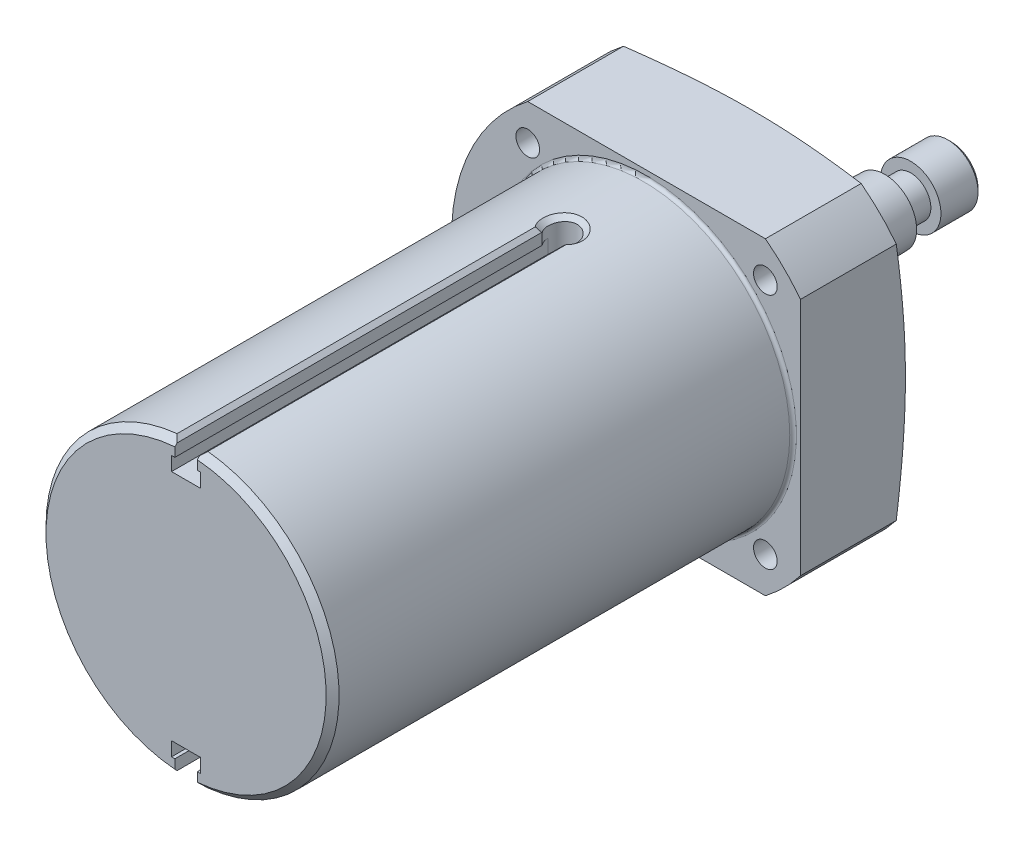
SolidWorks part; units mm, degrees
ref_plane "Front Plane" through (0, 0, 0) normal (0, 0, 1) x (1, 0, 0)
ref_plane "Top Plane" through (0, 0, 0) normal (0, 1, 0) x (1, 0, 0)
ref_plane "Right Plane" through (0, 0, 0) normal (1, 0, 0) x (0, 0, -1)
sketch "Sketch1" plane through (0, 0, 0) normal (0, 0, 1) x (1, 0, 0)
  line L0 (0, 0) -> (62.0084, 0) construction
  line L1 (-28.0574, 36.4998) -> (28.0574, 36.4998)
  line L2 (36.3474, 28.2545) -> (36.3474, -28.2545)
  line L3 (-28.0574, -36.4998) -> (28.0574, -36.4998)
  arc A0 (-28.0574, 36.4998) -> (-28.0574, -36.4998) centre (0, 0) ccw
  arc A1 (36.3474, 28.2545) -> (28.0574, 36.4998) centre (0, 0) ccw
  arc A2 (28.0574, -36.4998) -> (36.3474, -28.2545) centre (0, 0) ccw
  dimension "D1" = 92.075
  dimension "D2" = 72.9996
  dimension "D3" = 36.3474
extrude "Extrude1" add sketch "Sketch1" along normal blind 138.938
sketch "Sketch2" plane through (0, 0, 0) normal (0, 1, 0) x (1, 0, 0)
  line L0 (0, 0) -> (0, -96.9332) construction
  line L1 (-46.0375, -30.226) -> (-34.5948, -30.226)
  line L2 (-46.0375, 0) -> (-46.0375, -138.938) construction
  line L3 (-34.5948, -30.226) -> (-34.5948, -138.938)
  line L5 (-11.7475, 0) -> (-46.0375, -7.62)
  line L6 (28.0574, 0) -> (-28.0574, 0) construction
  line L7 (-34.5948, -138.938) -> (-46.0375, -138.938)
  line L8 (-46.0375, -138.938) -> (-46.0375, -30.226)
  line L9 (-46.0375, -7.62) -> (-46.0375, 0)
  line L10 (-28.0574, 0) -> (-46.0375, 0) construction
  line L11 (-46.0375, 0) -> (-11.7475, 0)
  dimension "D1" = 108.712
  dimension "D2" = 69.1896
  dimension "D5" = 23.495
  dimension "D6" = 7.62
revolve "Cut-Revolve1" cut sketch "Sketch2" angle 360 about L0
sketch "Sketch4" plane through (0, 0, 0) normal (0, 1, 0) x (1, 0, 0)
  line L0 (0, 0) -> (0, -99.9671) construction
  line L1 (7.9311, 0) -> (7.9311, 13.081)
  line L2 (11.7475, 0) -> (-11.7475, 0) construction
  line L3 (7.9311, 13.081) -> (7.5247, 26.0129)
  line L4 (7.5247, 26.0129) -> (0, 26.0129)
  line L5 (-28.0574, -30.226) -> (28.0574, -30.226) construction
  line L7 (0, 26.0129) -> (0, 0)
  line L8 (0, 0) -> (7.9311, 0)
  dimension "D1" = 1.8
  dimension "D2" = 43.307
  dimension "D4" = 15.8623
  dimension "D5" = 15.0495
  dimension "D6" = 12.9319
revolve "Revolve1" add sketch "Sketch4" angle 360 about L0
hole_wizard "Hole1" positions "Sketch6" profile "Sketch5" legacy
sketch "Sketch6" plane through (0, 0, -26.0129) normal (0, 0, -1) x (-1, 0, 0)
  circle A0 centre (0, 0) radius 7.5247 construction
  point P0 (0, 0)
sketch "Sketch5" plane through (0, 0, -26.0129) normal (1, 0, 0) x (0, 1, 0)
  line L0 (0, 0) -> (0, 21.5835)
  line L1 (0, 21.5835) -> (4.2164, 19.05)
  line L2 (4.2164, 19.05) -> (4.2164, 0)
  line L4 (4.2164, 0) -> (0, 0)
  line L6 (0, 21.5835) -> (-4.2164, 19.05) construction
  line L7 (0, -4.2442) -> (0, 117.3081) construction
  dimension "Diameter" = 8.4328
  dimension "Depth" = 19.05
  dimension "Drill Angle" = 118
hole_wizard "Hole2" positions "Sketch10" profile "Sketch9" legacy
sketch "Sketch10" plane through (4.4648, 0.3939, 0) normal (0, 0, 1) x (1, 0, 0)
  line L1 (-4.4648, -0.3939) -> (19.5659, -0.3939) construction
  line L2 (-4.4648, -0.3939) -> (23.5805, 27.6515) construction
  circle A0 centre (-4.4648, -0.3939) radius 39.6621 construction
  point P0 (23.5805, 27.6515)
  dimension "D2" = 79.3242
  dimension "D1" = 45
sketch "Sketch9" plane through (28.0453, 28.0453, 0) normal (1, 0, 0) x (0, 1, 0)
  line L0 (0, 0) -> (0, 30.227)
  line L1 (0, 30.227) -> (2.794, 30.227)
  line L2 (2.794, 30.227) -> (2.794, 10.1092)
  line L3 (2.794, 10.1092) -> (4.7625, 10.1092)
  line L4 (4.7625, 10.1092) -> (4.7625, 0)
  line L5 (4.7625, 0) -> (0, 0)
  line L6 (0, 110) -> (0, -10) construction
  dimension "Diameter" = 5.588
  dimension "Depth" = 30.227
  dimension "C-Bore Diameter" = 9.525
  dimension "C-Bore Depth" = 10.1092
pattern_circular "CirPattern1" count 4 over 360 about axis through (0, 0, 0) along (0, 0, 1) of "Hole2"
ref_plane "Plane1" through (0, 0, 22.3012) normal (0, 0, 1) x (1, 0, 0)
sketch "Sketch11" plane through (0, 0, 22.3012) normal (0, 0, 1) x (1, 0, 0)
  line L0 (0, 0) -> (19.628, -9.1527) construction
  line L1 (0, 0) -> (27.0444, 0) construction
  line L2 (-80.9615, 33.1567) -> (-34.9211, 11.6877)
  line L3 (-34.9211, 11.6877) -> (-33.1606, 15.4631)
  line L4 (-33.1606, 15.4631) -> (-79.2011, 36.9321)
  line L5 (-79.2011, 36.9321) -> (-80.9615, 33.1567)
  dimension "D1" = 25
  dimension "D2" = 36.5887
  dimension "D3" = 8.3312
  dimension "D4" = 50.8
revolve "Cut-Revolve2" cut sketch "Sketch11" angle 360 about L0
mirror "Mirror1" about plane through (0, 0, 0) normal (0, 1, 0) of "Cut-Revolve2"
sketch "Sketch12" plane through (0, 0, 138.938) normal (0, 0, 1) x (1, 0, 0)
  line L0 (0, 0) -> (0, 26.7352) construction
  line L1 (-2.6416, 50.8) -> (-2.6416, 30.8102)
  line L2 (-2.6416, 30.8102) -> (-3.429, 30.8102)
  line L3 (-3.429, 30.8102) -> (-3.429, 27.5082)
  line L4 (-3.429, 27.5082) -> (3.429, 27.5082)
  line L5 (3.429, 30.8102) -> (3.429, 27.5082)
  line L6 (2.6416, 30.8102) -> (3.429, 30.8102)
  line L7 (2.6416, 50.8) -> (2.6416, 30.8102)
  line L8 (-2.6416, 50.8) -> (2.6416, 50.8)
  dimension "D1" = 5.2832
  dimension "D2" = 6.858
  dimension "D3" = 3.302
  dimension "D4" = 27.5082
  dimension "D5" = 50.8
extrude "Cut-Extrude1" cut sketch "Sketch12" against normal blind 88.9
sketch "Sketch13" plane through (0, 0, 138.938) normal (0, 0, 1) x (1, 0, 0)
  line L0 (0, 0) -> (32.0428, 0) construction
  line L1 (0, 0) -> (0, -27.5102) construction
  line L2 (-3.429, -27.5082) -> (3.429, -27.5082)
  line L3 (3.429, -27.5082) -> (3.429, -30.8102)
  line L4 (3.429, -30.8102) -> (2.6416, -30.8102)
  line L5 (2.6416, -30.8102) -> (2.6416, -50.8)
  line L6 (2.6416, -50.8) -> (-2.6416, -50.8)
  line L7 (-3.429, 27.5082) -> (3.429, 27.5082) construction
  line L8 (3.429, 30.8102) -> (3.429, 27.5082) construction
  line L9 (2.6416, 50.8) -> (2.6416, 30.8102) construction
  line L10 (-2.6416, -30.8102) -> (-2.6416, -50.8)
  line L11 (-3.429, -30.8102) -> (-2.6416, -30.8102)
  line L12 (-3.429, -27.5082) -> (-3.429, -30.8102)
extrude "Cut-Extrude2" cut sketch "Sketch13" against normal blind 73.152
sketch "Sketch14" plane through (0, 36.4998, 0) normal (0, 1, 0) x (1, 0, 0)
  line L0 (-2.6416, -50.038) -> (2.6416, -50.038) construction
  circle A0 centre (0, -50.038) radius 3.429
  dimension "D1" = 3.429
extrude "Cut-Extrude3" cut sketch "Sketch14" against normal up to surface (8.9916 mm away)
sketch "Sketch15" plane through (0, -36.4998, 0) normal (0, -1, 0) x (1, 0, 0)
  line L0 (3.429, 65.786) -> (-3.429, 65.786) construction
  circle A0 centre (0, 65.786) radius 3.429
  dimension "D1" = 3.429
extrude "Cut-Extrude4" cut sketch "Sketch15" against normal up to surface (8.9916 mm away)
sketch "Sketch16" plane through (0, 0, 0) normal (0, 1, 0) x (1, 0, 0)
  line L0 (0, 0) -> (0, -122.9241) construction
  line L1 (4.7625, 26.0129) -> (4.7625, 32.131)
  line L2 (7.5247, 26.0129) -> (-7.5247, 26.0129) construction
  line L3 (4.7625, 32.131) -> (7.1374, 32.131)
  line L4 (7.1374, 32.131) -> (7.1374, 40.894)
  line L5 (7.1374, 40.894) -> (6.3754, 41.656)
  line L6 (6.3754, 41.656) -> (0, 41.656)
  line L7 (0, 41.656) -> (0, 26.0129)
  line L8 (0, 26.0129) -> (4.7625, 26.0129)
  line L9 (-7.9311, 13.081) -> (7.9311, 13.081) construction
  dimension "D1" = 9.525
  dimension "D2" = 19.05
  dimension "D3" = 14.2748
  dimension "D4" = 9.525
  dimension "D5" = 45
  dimension "D6" = 12.7508
revolve "Revolve2" add sketch "Sketch16" angle 360 about L0
sketch "Sketch17" plane through (0, 0, -41.656) normal (0, 0, -1) x (-1, 0, 0)
  line L1 (3.9624, -2.2877) -> (3.9624, 2.2877)
  line L2 (3.9624, 2.2877) -> (0, 4.5754)
  line L3 (0, 4.5754) -> (-3.9624, 2.2877)
  line L4 (-3.9624, 2.2877) -> (-3.9624, -2.2877)
  line L5 (-3.9624, -2.2877) -> (0, -4.5754)
  line L6 (0, -4.5754) -> (3.9624, -2.2877)
  circle A0 centre (0, 0) radius 3.9624 construction
  dimension "D1" = 7.9248
extrude "Cut-Extrude5" cut sketch "Sketch17" against normal blind 6.35
chamfer "Chamfer1" distance 1.524 angle 45 2 edges at (-34.5948, 0, 138.938) (34.5948, 0, 138.938)
fillet "Fillet1" radius 0.7874 1 edges at (-34.5948, 0, 30.226)
chamfer "Chamfer2" distance 0.9906 angle 48.03 6 edges at (2.6416, -34.4938, 102.6932) (-0.3766, -34.5927, 69.1943) (-2.6416, -34.4938, 102.6932) (-2.6416, 34.4938, 94.8192) (-0.3766, 34.5927, 46.6297) (2.6416, 34.4938, 94.8192)
